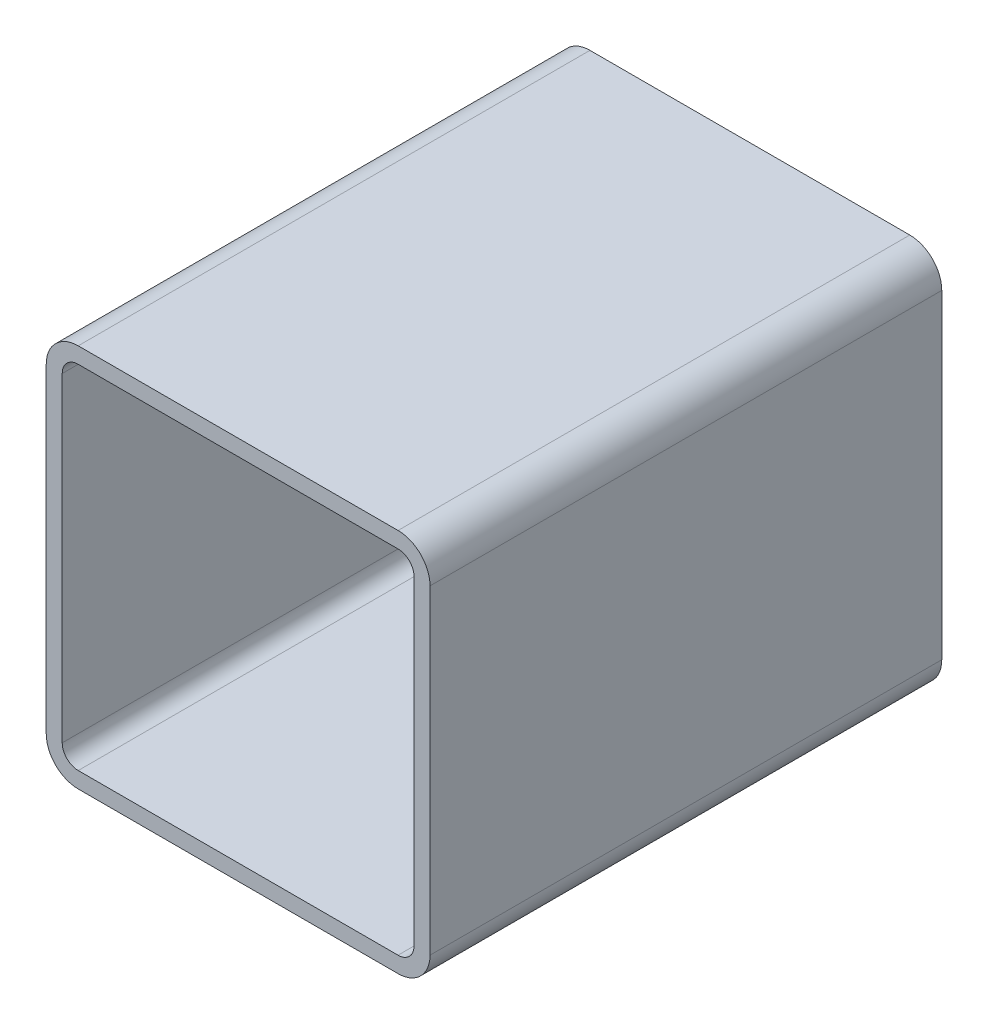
SolidWorks part; units mm, degrees
ref_plane "Front Plane" through (0, 0, 0) normal (0, 0, 1) x (1, 0, 0)
ref_plane "Top Plane" through (0, 0, 0) normal (0, 1, 0) x (1, 0, 0)
ref_plane "Right Plane" through (0, 0, 0) normal (1, 0, 0) x (0, 0, -1)
sketch "Sketch1" plane through (0, 0, 0) normal (0, 0, 1) x (1, 0, 0)
sketch_block_instance "HSS9x9x0.375-1"
sketch_block "HSS9x9x0.375"
extrude "Boss-Extrude1" add sketch "Sketch1" along normal blind 304.8
